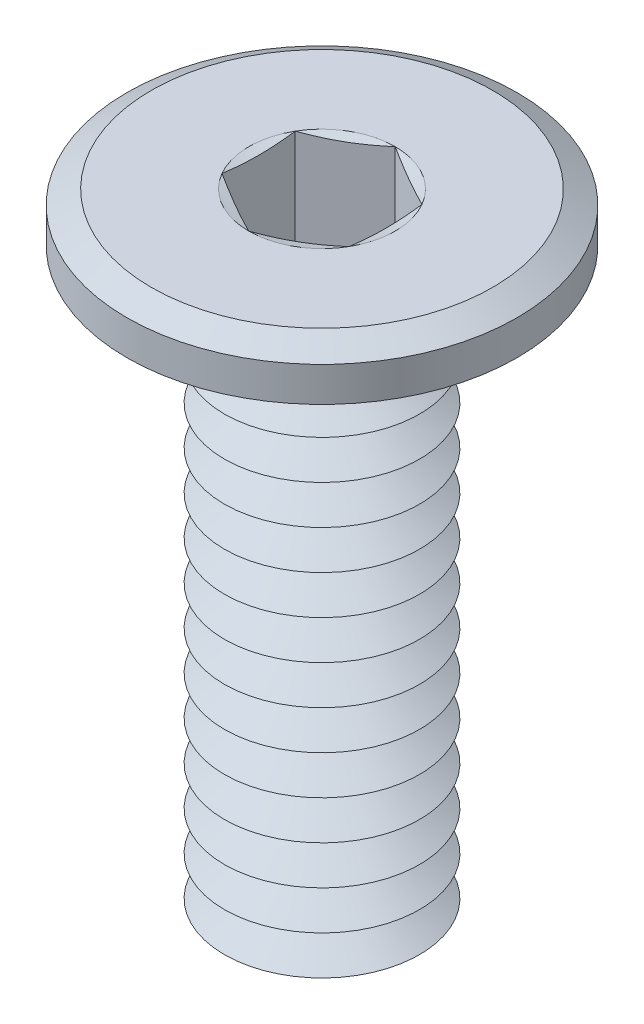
SolidWorks part; units mm, degrees
ref_plane "Front Plane" through (0, 0, 0) normal (0, 0, 1) x (1, 0, 0)
ref_plane "Top Plane" through (0, 0, 0) normal (0, 1, 0) x (1, 0, 0)
ref_plane "Right Plane" through (0, 0, 0) normal (1, 0, 0) x (0, 0, -1)
sketch "Sketch1" plane through (0, 0, 0) normal (0, 1, 0) x (1, 0, 0)
  circle A0 centre (0, 0) radius 2
  dimension "D1" = 4
extrude "Boss-Extrude1" add sketch "Sketch1" against normal blind 0.5
sketch "Sketch2" plane through (0, -0.5, 0) normal (0, -1, 0) x (1, 0, 0)
  circle A0 centre (0, 0) radius 1
  dimension "D1" = 2
extrude "Boss-Extrude2" add sketch "Sketch2" along normal blind 6
sketch "Sketch3" plane through (0, 0, 0) normal (1, 0, 0) x (0, 0, -1)
  line L0 (0, 0.9906) -> (0, -8.2999) construction
sketch "Sketch5" plane through (0, 0, 0) normal (1, 0, 0) x (0, 0, -1)
  line L0 (-1, -6.7) -> (-0.6536, -6.5)
  line L1 (-1, -0.5) -> (-1, -6.5) construction
  line L2 (-0.6536, -6.5) -> (-1, -6.3)
  line L3 (-1, -0.5) -> (-1, -6.5) construction
  line L4 (-1, -6.3) -> (-1, -6.7)
  line L6 (-1, -0.5) -> (-1, -6.5) construction
  line L7 (-1, -0.5) -> (-1, -6.5) construction
  line L14 (-1, -6.5) -> (1, -6.5) construction
  dimension "D1" = 0.4
revolve "Cut-Revolve1" cut sketch "Sketch5" angle 360 about L0
pattern_linear "LPattern1" count 14 spacing 0.4 along (0, 1, 0) of "Cut-Revolve1"
fillet "Fillet1" radius 0.1 1 edges at (0, -0.5, -1)
chamfer "Chamfer2" distance 0.25 angle 30 1 edges at (0, 0, 2)
sketch "Sketch6" plane through (0, 0, 0) normal (0, 1, 0) x (1, 0, 0)
  line L1 (0, 0.7506) -> (-0.65, 0.3753)
  line L2 (-0.65, 0.3753) -> (-0.65, -0.3753)
  line L3 (-0.65, -0.3753) -> (0, -0.7506)
  line L4 (0, -0.7506) -> (0.65, -0.3753)
  line L5 (0.65, -0.3753) -> (0.65, 0.3753)
  line L6 (0.65, 0.3753) -> (0, 0.7506)
  circle A0 centre (0, 0) radius 0.65 construction
  dimension "D1" = 1.3
extrude "Cut-Extrude1" cut sketch "Sketch6" against normal blind 1.2
sketch "Sketch7" plane through (0, -1.2, 0) normal (0, 1, 0) x (1, 0, 0)
  line L0 (-0.65, 0.3753) -> (-0.65, -0.3753) construction
  circle A0 centre (0, 0) radius 0.65
extrude "Cut-Extrude2" cut sketch "Sketch7" against normal through all draft 60
sketch "Sketch8" plane through (0, 0, 0) normal (0, 1, 0) x (1, 0, 0)
  circle A0 centre (0, 0) radius 0.7506
extrude "Cut-Extrude3" cut sketch "Sketch8" against normal through all draft 75
